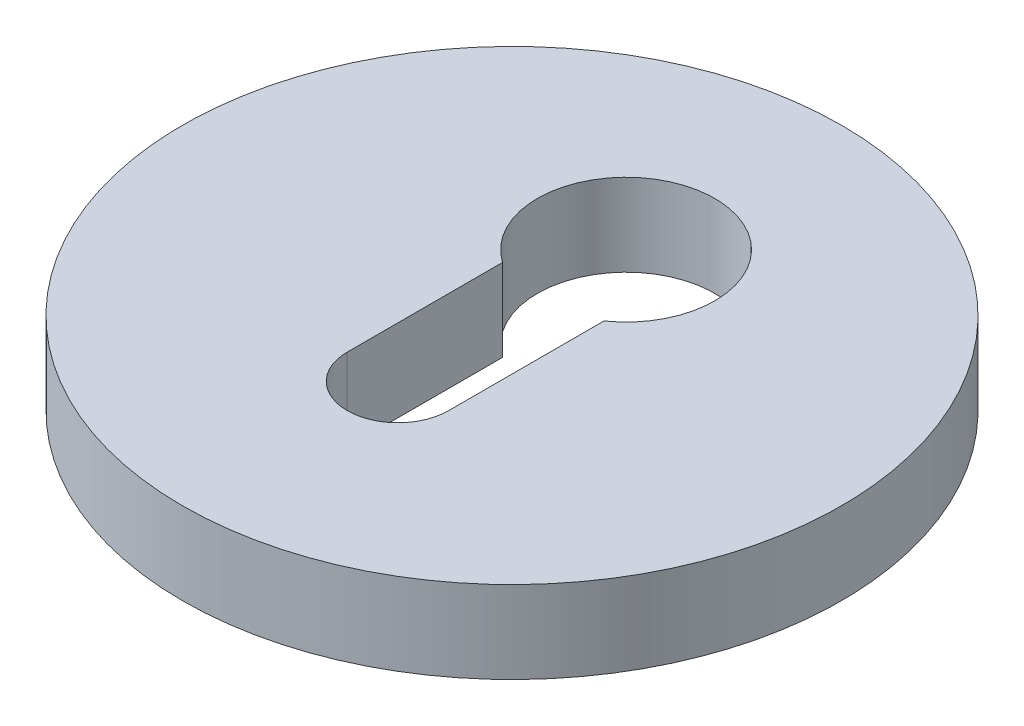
SolidWorks part; units mm, degrees
ref_plane "Front Plane" through (0, 0, 0) normal (0, 0, 1) x (1, 0, 0)
ref_plane "Top Plane" through (0, 0, 0) normal (0, 1, 0) x (1, 0, 0)
ref_plane "Right Plane" through (0, 0, 0) normal (1, 0, 0) x (0, 0, -1)
sketch "Sketch1" plane through (0, 0, 0) normal (0, 1, 0) x (1, 0, 0)
  circle A0 centre (0, 0) radius 16.51
  dimension "D1" = 33.02
extrude "Boss-Extrude1" add sketch "Sketch1" along normal blind 4.1206
sketch "Sketch2" plane through (0, 4.1206, 0) normal (0, 1, 0) x (1, 0, 0)
  line L0 (0, 5.715) -> (0, -5.715) construction
  line L1 (2.54, 5.715) -> (2.54, -5.715)
  line L2 (-2.54, 5.715) -> (-2.54, -5.715)
  arc A0 (2.54, 5.715) -> (-2.54, 5.715) centre (0, 5.715) ccw
  arc A1 (-2.54, -5.715) -> (2.54, -5.715) centre (0, -5.715) ccw
  circle A2 centre (0, 5.715) radius 4.445
  circle A3 centre (0, 0) radius 16.51 construction
  point P3 (0, 0)
  dimension "D3" = 8.89
  dimension "D1" = 11.43
  dimension "D2" = 5.08
extrude "Cut-Extrude1" cut sketch "Sketch2" against normal blind 25.4
